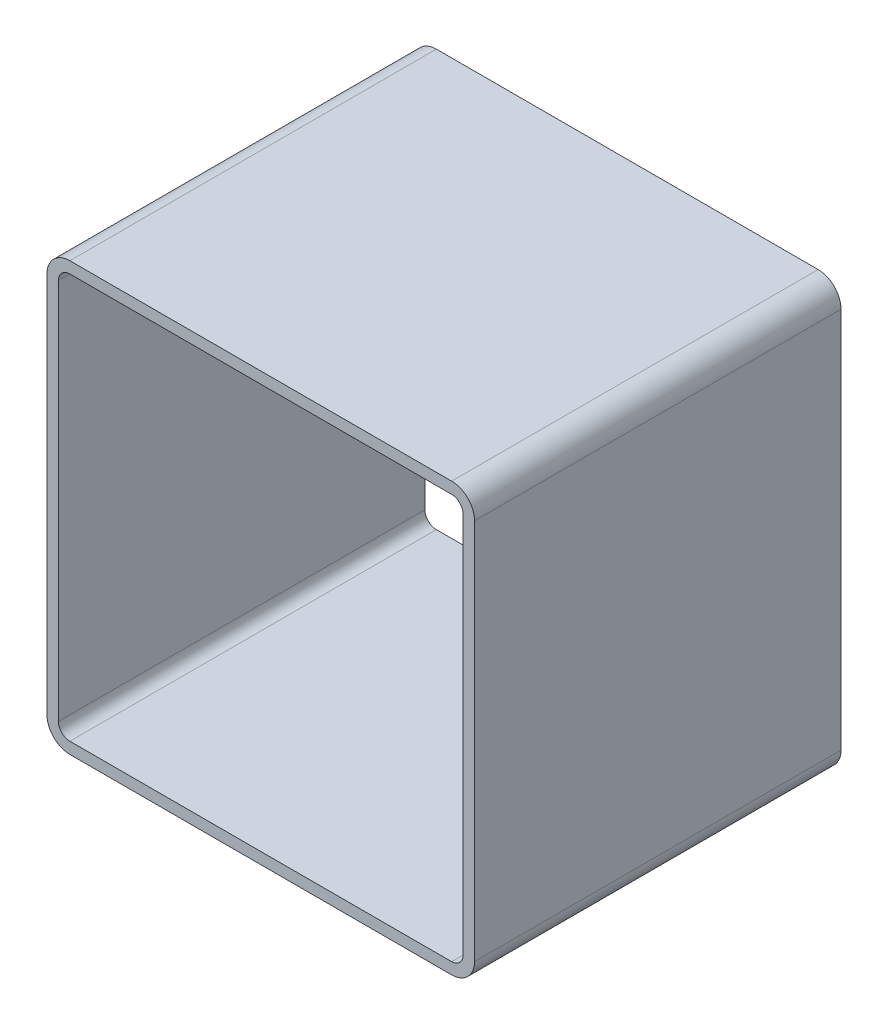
SolidWorks part; units mm, degrees
ref_plane "Front Plane" through (0, 0, 0) normal (0, 0, 1) x (1, 0, 0)
ref_plane "Top Plane" through (0, 0, 0) normal (0, 1, 0) x (1, 0, 0)
ref_plane "Right Plane" through (0, 0, 0) normal (1, 0, 0) x (0, 0, -1)
sketch "Sketch1" plane through (0, 0, 0) normal (0, 0, 1) x (1, 0, 0)
sketch_block_instance "HSS14x14x0.375-1"
sketch_block "HSS14x14x0.375"
extrude "Boss-Extrude1" add sketch "Sketch1" along normal blind 304.8
